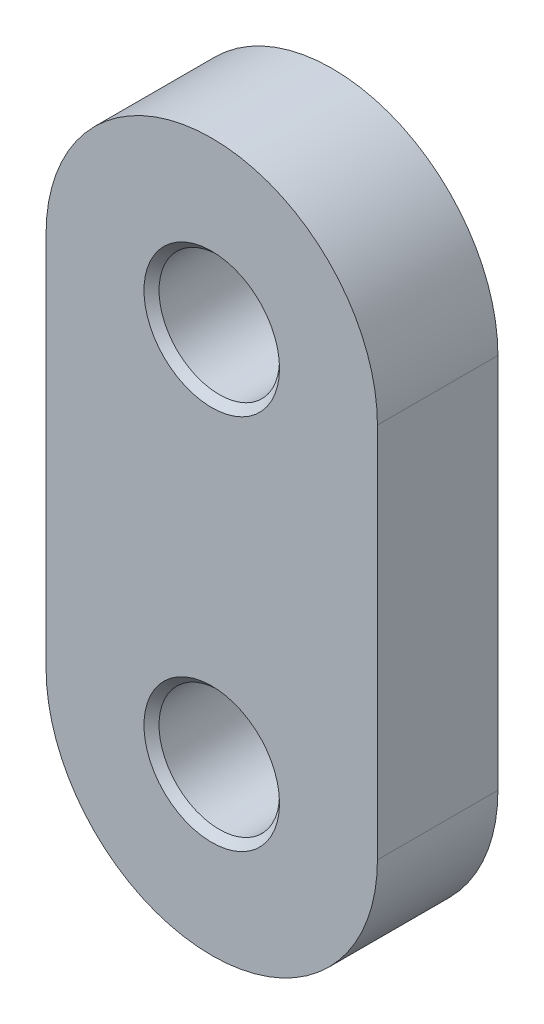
SolidWorks part; units mm, degrees
ref_plane "Plane1" through (0, 0, 0) normal (0, 0, 1) x (1, 0, 0)
ref_plane "Plane2" through (0, 0, 0) normal (0, 1, 0) x (1, 0, 0)
ref_plane "Plane3" through (0, 0, 0) normal (1, 0, 0) x (0, 0, -1)
sketch "Esquisse1" plane through (0, 0, 0) normal (0, 0, 1) x (1, 0, 0)
  line L0 (-11, 0) -> (-11, -25)
  line L1 (11, -25) -> (11, 0)
  arc A0 (-11, -25) -> (11, -25) centre (0, -25) ccw
  arc A1 (11, 0) -> (-11, 0) centre (0, 0) ccw
  dimension "D1" = 22
  dimension "D2" = 25
extrude "Base-Extrusion" add sketch "Esquisse1" along normal blind 8
sketch "Esquisse2" plane through (0, 0, 8) normal (0, 0, 1) x (1, 0, 0)
  circle A0 centre (0, 0) radius 4
  dimension "D1" = 8
extrude "Enlèv. mat.-Extru.1" cut sketch "Esquisse2" against normal through all
sketch "Esquisse3" plane through (-1.4906, -22.4003, 8) normal (0, 0, 1) x (1, 0, 0)
  circle A0 centre (1.4906, -2.5997) radius 4
  arc A2 (-9.5094, -2.5997) -> (12.4906, -2.5997) centre (1.4906, -2.5997) ccw construction
  dimension "D1" = 8
extrude "Enlèv. mat.-Extru.2" cut sketch "Esquisse3" against normal through all
chamfer "Chanfrein1" distance 0.5 angle 45 4 edges at (4, 0, 0) (4, 0, 8) (4, -25, 0) (4, -25, 8)
